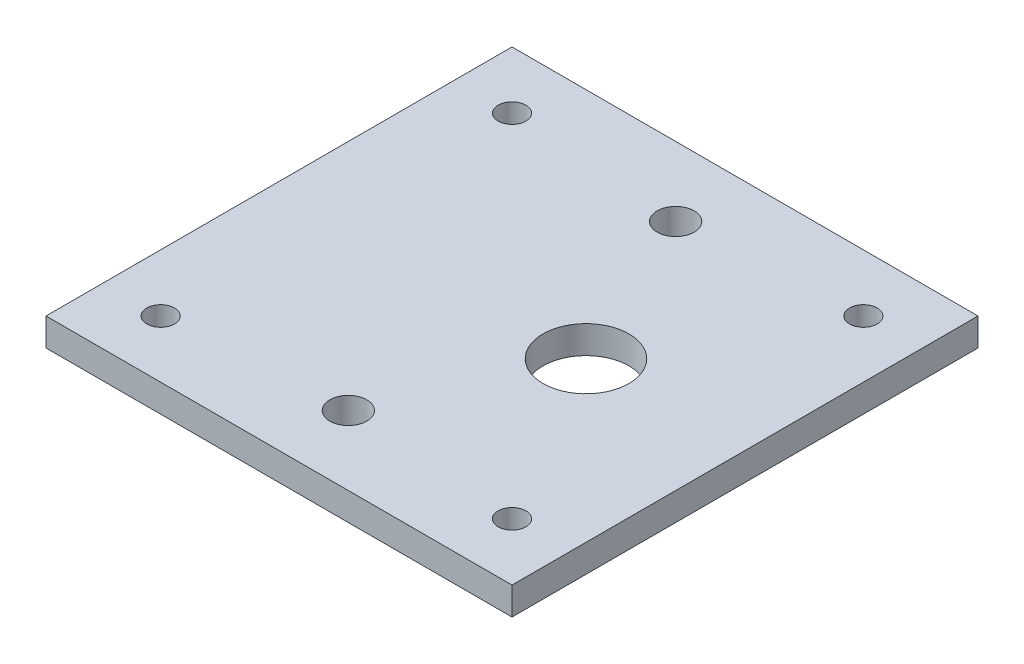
SolidWorks part; units mm, degrees
ref_plane "前视基准面" through (0, 0, 0) normal (0, 0, 1) x (1, 0, 0)
ref_plane "上视基准面" through (0, 0, 0) normal (0, 1, 0) x (1, 0, 0)
ref_plane "右视基准面" through (0, 0, 0) normal (1, 0, 0) x (0, 0, -1)
sketch "草图2" plane through (0, 0, 0) normal (0, 1, 0) x (1, 0, 0)
  line L0 (0, 82.3651) -> (0, -61.7315) construction
  line L1 (-25.2, 25.2) -> (25.2, 25.2)
  line L2 (-25.2, 25.2) -> (-25.2, -25.2)
  line L3 (-25.2, -25.2) -> (25.2, -25.2)
  line L4 (25.2, 25.2) -> (25.2, -25.2)
  line L5 (-25.2, 25.2) -> (25.2, -25.2) construction
  line L6 (-25.2, -25.2) -> (25.2, 25.2) construction
  line L7 (-92.1745, 0) -> (112.4698, 0) construction
  point P0 (0, 0)
  dimension "D1" = 50.4
  dimension "D2" = 50.4
extrude "凸台-拉伸1" add sketch "草图2" against normal blind 3
sketch "草图3" plane through (0, 0, 0) normal (0, 1, 0) x (1, 0, 0)
  line L0 (-31.4477, 0) -> (38.2819, 0) construction
  line L1 (0, 26.7492) -> (0, -28.5646) construction
  circle A0 centre (0, 17.7) radius 2
  circle A1 centre (0, -17.7) radius 2
  dimension "D1" = 4
  dimension "D2" = 17.7
extrude "切除-拉伸1" cut sketch "草图3" against normal through all and the other way through all
sketch "草图4" plane through (0, 0, 0) normal (0, 1, 0) x (1, 0, 0)
  line L0 (-46.7177, 0) -> (39.2429, 0) construction
  line L1 (0, 26.6425) -> (0, -30.0595) construction
  circle A0 centre (-19, 19) radius 1.5
  circle A1 centre (19, 19) radius 1.5
  circle A2 centre (19, -19) radius 1.5
  circle A3 centre (-19, -19) radius 1.5
  circle A4 centre (8, 0) radius 4.65
  point P16 (0, 0)
  dimension "D1" = 3
  dimension "D6" = 9.3
  dimension "D2" = 19
  dimension "D3" = 19
  dimension "D5" = 8
  dimension "D4" = 4
extrude "切除-拉伸2" cut sketch "草图4" along direction (0, 1, 0) on the side against the normal up to next (3 mm away)
ref_plane "基准面1" through (0, -10, 0) normal (0, 1, 0) x (1, 0, 0)
ref_point "点2"
